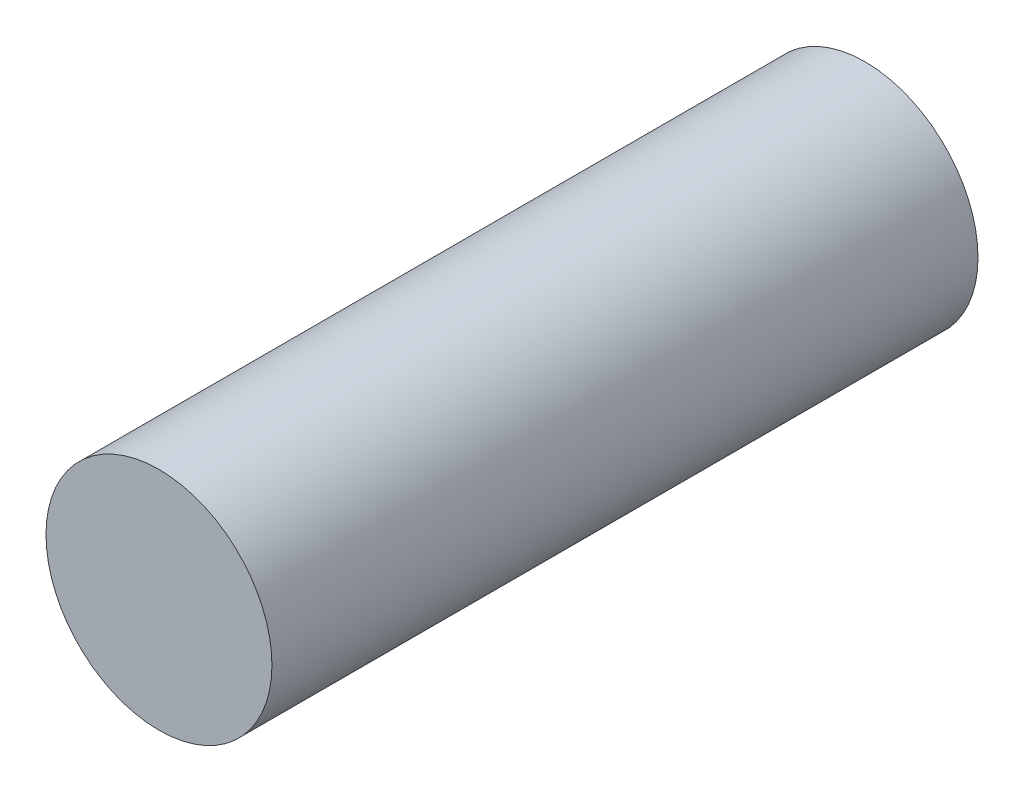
SolidWorks part; units mm, degrees
ref_plane "Plan de face" through (0, 0, 0) normal (0, 0, 1) x (1, 0, 0)
ref_plane "Plan de dessus" through (0, 0, 0) normal (0, 1, 0) x (1, 0, 0)
ref_plane "Plan de droite" through (0, 0, 0) normal (1, 0, 0) x (0, 0, -1)
sketch "Esquisse1" plane through (0, 0, 0) normal (0, 0, 1) x (1, 0, 0)
  circle A0 centre (0, 0) radius 4
  dimension "D1" = 8
extrude "Extrusion1" add sketch "Esquisse1" along normal blind 25
